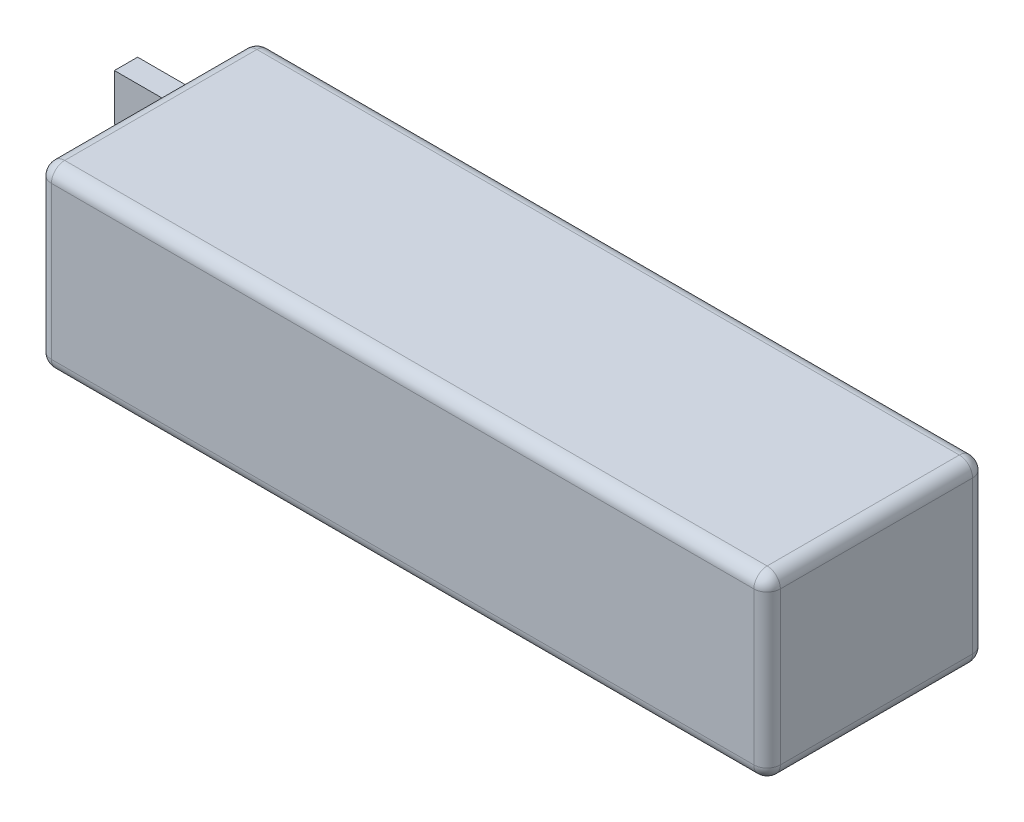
SolidWorks part; units mm, degrees
ref_plane "Plano frontal" through (0, 0, 0) normal (0, 0, 1) x (1, 0, 0)
ref_plane "Plano superior" through (0, 0, 0) normal (0, 1, 0) x (1, 0, 0)
ref_plane "Plano direito" through (0, 0, 0) normal (1, 0, 0) x (0, 0, -1)
sketch "Esboço2" plane through (0, 0, 0) normal (0, 1, 0) x (1, 0, 0)
  line L1 (0, 0) -> (110, 0)
  line L2 (0, 0) -> (0, 33)
  line L3 (0, 33) -> (110, 33)
  line L4 (110, 0) -> (110, 33)
  dimension "D1" = 33
  dimension "D2" = 110
extrude "Ressalto-extrusão1" add sketch "Esboço2" along normal blind 27
fillet "Filete1" radius 2 12 edges at (0, 13.5, -33) (110, 13.5, -33) (0, 13.5, 0) (110, 13.5, 0) (55, 27, -33) (110, 27, -16.5) (55, 27, 0) (0, 27, -16.5) (55, 0, 0) (110, 0, -16.5) (55, 0, -33) (0, 0, -16.5)
sketch "Esboço3" plane through (0, 0, 0) normal (-1, 0, 0) x (0, 0, 1)
  line L0 (-31, 10) -> (-31, 17)
  line L1 (-31, 25) -> (-31, 2) construction
  line L2 (-31, 17) -> (-27.5, 17)
  line L3 (-27.5, 17) -> (-27.5, 10)
  line L4 (-27.5, 10) -> (-31, 10)
  point P5 (-31, 13.5)
  dimension "D1" = 7
  dimension "D2" = 3.5
extrude "Ressalto-extrusão2" add sketch "Esboço3" along normal blind 16
